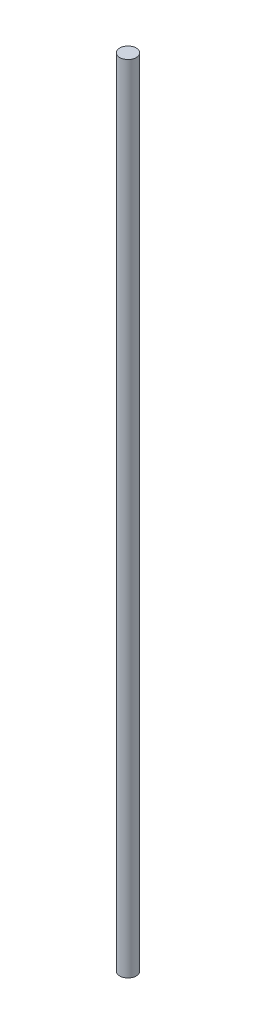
SolidWorks part; units mm, degrees
ref_plane "Front" through (0, 0, 0) normal (0, 0, 1) x (1, 0, 0)
ref_plane "Top" through (0, 0, 0) normal (0, 1, 0) x (1, 0, 0)
ref_plane "Right" through (0, 0, 0) normal (1, 0, 0) x (0, 0, -1)
sketch "Sketch1" plane through (0, 0, 0) normal (0, 1, 0) x (1, 0, 0)
  circle A0 centre (0, 0) radius 3.175
  dimension "D1" = 6.35
extrude "Extrude1" add sketch "Sketch1" along normal blind 304.8
